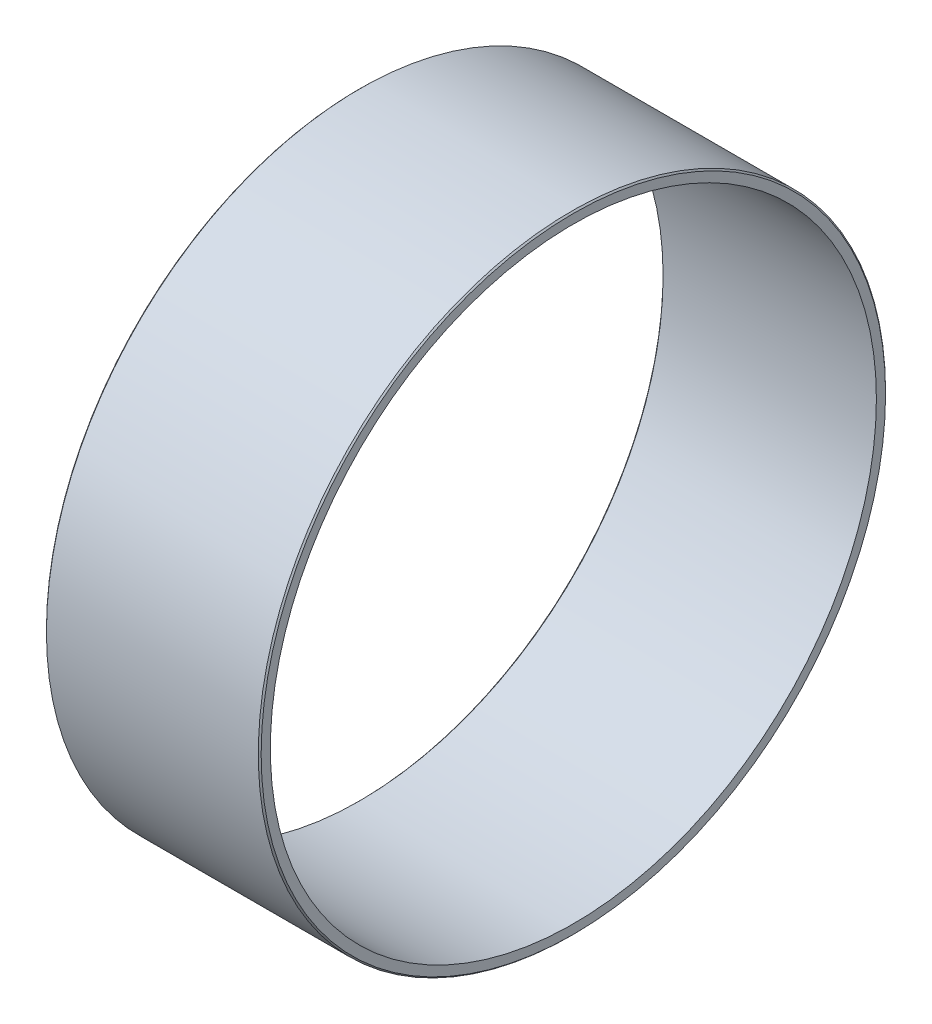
SolidWorks part; units mm, degrees
ref_plane "Plan de face" through (0, 0, 0) normal (0, 0, 1) x (1, 0, 0)
ref_plane "Plan de dessus" through (0, 0, 0) normal (0, 1, 0) x (1, 0, 0)
ref_plane "Plan de droite" through (0, 0, 0) normal (1, 0, 0) x (0, 0, -1)
sketch "Esquisse1" plane through (0, 0, 0) normal (0, 0, 1) x (1, 0, 0)
  line L0 (0, 0) -> (-98.8944, 0) construction
  line L1 (0, 105.84) -> (0, 109.55)
  line L4 (0, 109.55) -> (-75, 109.55)
  line L5 (-75, 109.55) -> (-75, 105.84)
  line L6 (-75, 105.84) -> (0, 105.84)
  dimension "D2" = 75
  dimension "D3" = 219.1
  dimension "D5" = 3.71
revolve "Révolution1" add sketch "Esquisse1" angle 360 about L0
chamfer "Chanfrein1" distance 0.5 angle 45 2 edges at (-75, 0, -109.55) (-75, 0, -105.84)
chamfer "Chanfrein2" distance 0.5 angle 45 1 edges at (0, 0, -109.55)
